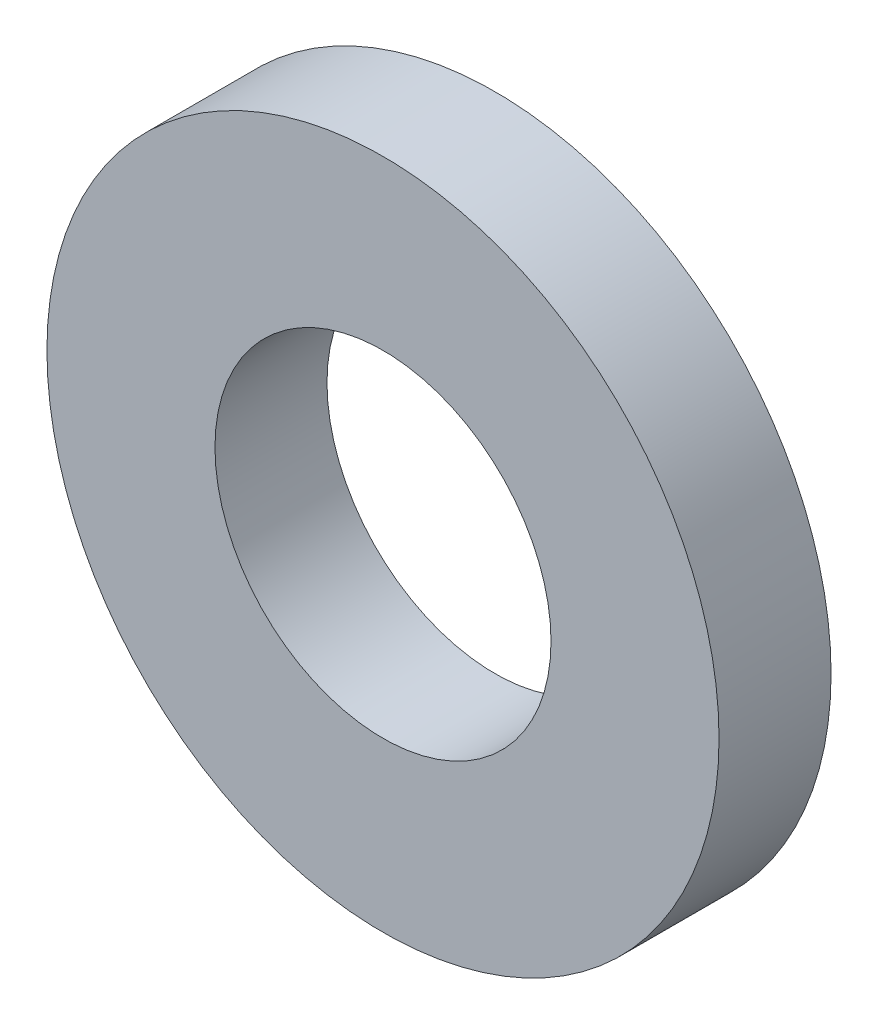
SolidWorks part; units mm, degrees
ref_plane "前视基准面" through (0, 0, 0) normal (0, 0, 1) x (1, 0, 0)
ref_plane "上视基准面" through (0, 0, 0) normal (0, 1, 0) x (1, 0, 0)
ref_plane "右视基准面" through (0, 0, 0) normal (1, 0, 0) x (0, 0, -1)
sketch "草图1" plane through (0, 0, 0) normal (0, 0, 1) x (1, 0, 0)
  circle A0 centre (0, 0) radius 9
  circle A1 centre (0, 0) radius 4.5
extrude "拉伸1" add sketch "草图1" along normal blind 3
